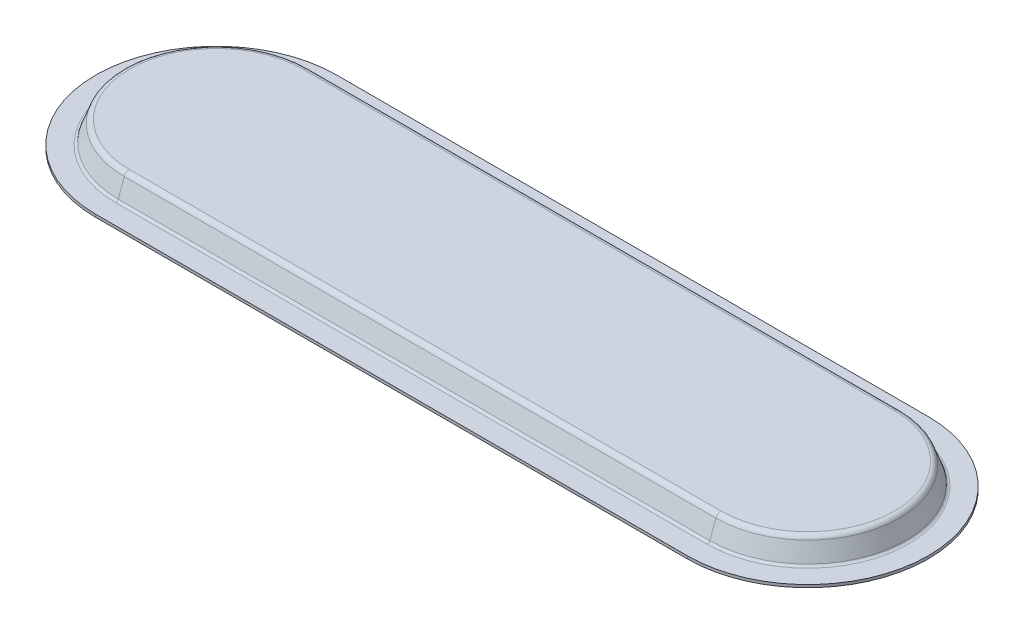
SolidWorks part; units mm, degrees
ref_plane "Front" through (0, 0, 0) normal (0, 0, 1) x (1, 0, 0)
ref_plane "Top" through (0, 0, 0) normal (0, 1, 0) x (1, 0, 0)
ref_plane "Right" through (0, 0, 0) normal (1, 0, 0) x (0, 0, -1)
sketch "Sketch1" plane through (0, 0, 0) normal (0, 1, 0) x (1, 0, 0)
  line L0 (0, 0) -> (133.6175, 0) construction
  line L1 (-171.45, 57.15) -> (171.45, 57.15)
  line L2 (-171.45, -57.15) -> (171.45, -57.15)
  line L3 (0, 0) -> (0, 53.095) construction
  arc A0 (171.45, 57.15) -> (171.45, -57.15) centre (171.45, 0) cw
  arc A1 (-171.45, 57.15) -> (-171.45, -57.15) centre (-171.45, 0) ccw
  dimension "D1" = 457.2
  dimension "D2" = 114.3
extrude "Base-Extrude" add sketch "Sketch1" along normal blind 12.7 draft 20
sketch "Sketch2" plane through (0, 0, 0) normal (0, -1, 0) x (1, 0, 0)
  line L2 (171.45, 69.85) -> (-171.45, 69.85)
  line L3 (-171.45, -69.85) -> (171.45, -69.85)
  line L4 (171.45, 69.85) -> (-171.45, 69.85)
  line L5 (-171.45, -69.85) -> (171.45, -69.85)
  arc A2 (171.45, -69.85) -> (171.45, 69.85) centre (171.45, 0) ccw
  arc A3 (-171.45, 69.85) -> (-171.45, -69.85) centre (-171.45, 0) ccw
  arc A4 (171.45, -69.85) -> (171.45, 69.85) centre (171.45, 0) ccw
  arc A5 (-171.45, 69.85) -> (-171.45, -69.85) centre (-171.45, 0) ccw
  dimension "D1" = 12.7
extrude "Boss-Extrude1" add sketch "Sketch2" along normal blind 12.7
fillet "Fillet1" radius 1.5875 4 edges at (0, 0, -57.15) (-228.6, 0, 0) (0, 0, 57.15) (228.6, 0, 0)
fillet "Fillet2" radius 3.175 4 edges at (-223.9776, 12.7, 0) (0, 12.7, -52.5276) (223.9776, 12.7, 0) (0, 12.7, 52.5276)
ref_plane "Plane1" through (0, 19.05, 0) normal (0, 1, 0) x (-1, 0, 0)
ref_plane "Plane2" through (0, 19.05, 0) normal (0, 1, 0) x (-1, 0, 0)
shell "Shell1" thickness 1.5875
sketch "Sketch4" plane through (0, 12.7, 0) normal (0, 1, 0) x (-1, 0, 0)
  line L0 (0, 117.9819) -> (0, -102.5569)
extrude "Cut-Extrude1" cut sketch "Sketch4" against normal through all flip side to cut
sketch "Sketch6" plane through (0, 11.1125, 0) normal (0, -1, 0) x (1, 0, 0)
  line L0 (-171.45, 0) -> (-171.45, 159.1007) construction
  line L1 (-171.45, 0) -> (-216.3637, 167.6203) construction
  dimension "D1" = 15
mirror "Boss-Mirror1" about plane through (-171.45, 0, 57.15) normal (0, 0.342, 0.9397)
